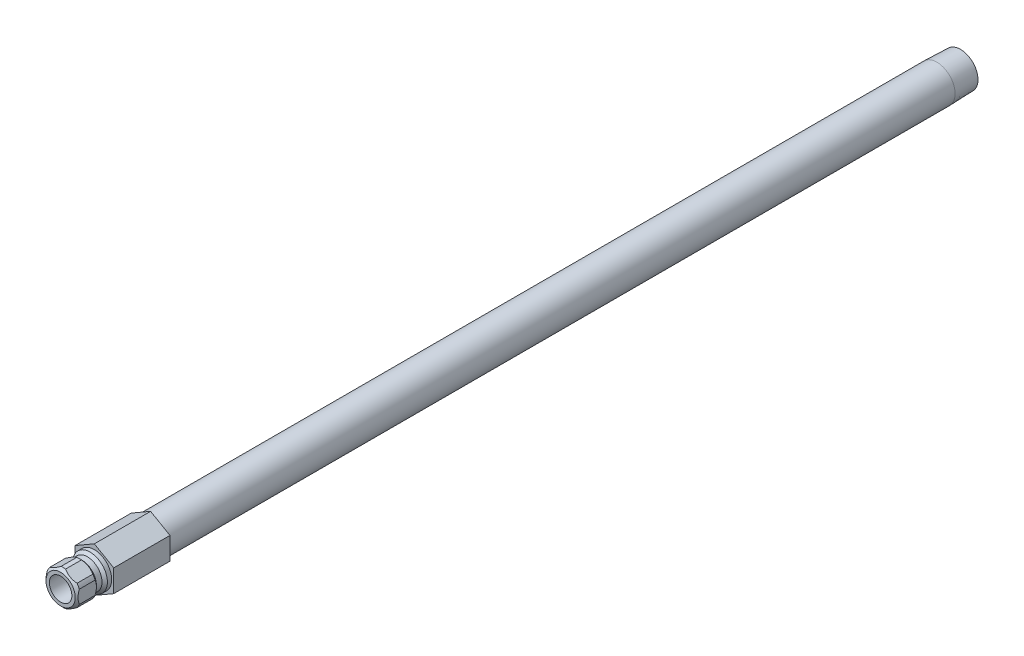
SolidWorks part; units mm, degrees
ref_plane "Front Plane" through (0, 0, 0) normal (0, 0, 1) x (1, 0, 0)
ref_plane "Top Plane" through (0, 0, 0) normal (0, 1, 0) x (1, 0, 0)
ref_plane "Right Plane" through (0, 0, 0) normal (1, 0, 0) x (0, 0, -1)
sketch "Sketch1" plane through (0, 0, 0) normal (1, 0, 0) x (0, 0, -1)
  line L0 (0, 0) -> (-12.7, 0) construction
  line L1 (-9.525, 3.175) -> (-9.525, 4.1275)
  line L2 (-3.556, 4.1275) -> (-3.556, 0) construction
  line L3 (-8.763, 4.8895) -> (-4.318, 4.8895)
  line L4 (0, 5.1435) -> (0, 3.4163) construction
  line L5 (-3.556, 4.1275) -> (-1.9685, 4.1275)
  line L6 (-1.2065, 4.8895) -> (0, 4.8895)
  line L7 (0, 4.8895) -> (0, 5.1435)
  line L8 (-3.556, 4.1275) -> (-4.318, 4.8895)
  line L9 (-1.9685, 4.1275) -> (-1.2065, 4.8895)
  line L10 (-9.525, 4.1275) -> (-8.763, 4.8895)
  line L12 (0, 5.1435) -> (237.7948, 5.1435)
  line L13 (237.7948, 5.1435) -> (244.475, 4.9347)
  line L14 (244.475, 4.9347) -> (244.475, 2.3813)
  line L15 (0, 0) -> (15.875, 0) construction
  line L16 (15.875, 0) -> (15.875, 4.8895) construction
  line L17 (15.875, 4.8895) -> (0, 4.8895) construction
  line L18 (0.127, 2.3813) -> (244.475, 2.3813)
  line L19 (0.127, 3.175) -> (-9.525, 3.175)
  line L20 (0, 3.175) -> (0, 0) construction
  line L21 (0.127, 2.3813) -> (0.127, 3.175)
  dimension "D1" = 9.525
  dimension "D2" = 1.5875
  dimension "D3" = 0.762
  dimension "D4" = 45
  dimension "D5" = 5.969
  dimension "D6" = 45
  dimension "D7" = 1.79
  dimension "D8" = 6.6802
  dimension "D9" = 254
  dimension "D10" = 3.175
  dimension "D11" = 25.4
  dimension "D12" = 4.7625
  dimension "D13" = 6.35
  dimension "D14" = 9.779
  dimension "D15" = 10.287
  dimension "D16" = 9.652
revolve "Revolve1" add sketch "Sketch1" angle 360 about L0
sketch "Sketch2" plane through (0, 0, 0) normal (0, 0, 1) x (1, 0, 0)
  line L1 (-5.461, 3.1529) -> (-5.461, -3.1529)
  line L2 (-5.461, -3.1529) -> (0, -6.3058)
  line L3 (0, -6.3058) -> (5.461, -3.1529)
  line L4 (5.461, -3.1529) -> (5.461, 3.1529)
  line L5 (5.461, 3.1529) -> (0, 6.3058)
  line L6 (0, 6.3058) -> (-5.461, 3.1529)
  circle A0 centre (0, 0) radius 5.461 construction
  circle A1 centre (0, 0) radius 2.3812 construction
  circle A2 centre (0, 0) radius 2.3812
  dimension "D1" = 10.922
extrude "Boss-Extrude1" add sketch "Sketch2" against normal up to vertex (15.875 mm away) from vertex at 0
sketch "Sketch3" plane through (0, 0, 0) normal (0, 0, 1) x (1, 0, 0)
  line L1 (-4.5212, -2.6103) -> (0, -5.2206)
  line L2 (0, -5.2206) -> (4.5212, -2.6103)
  line L3 (4.5212, -2.6103) -> (4.5212, 2.6103)
  line L4 (4.5212, 2.6103) -> (0, 5.2206)
  line L5 (0, 5.2206) -> (-4.5212, 2.6103)
  line L6 (-4.5212, 2.6103) -> (-4.5212, -2.6103)
  circle A0 centre (0, 0) radius 4.5212 construction
  dimension "D1" = 9.0424
extrude "Cut-Extrude1" cut sketch "Sketch3" along normal through all from vertex at 3.556 flip side to cut
